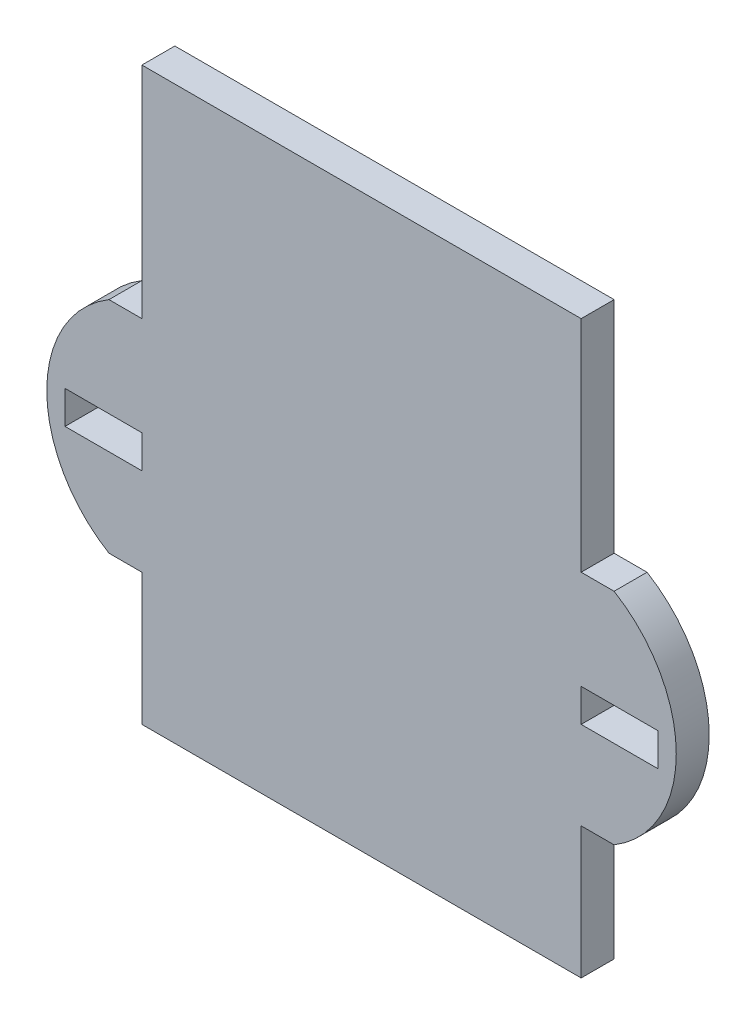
SolidWorks part; units mm, degrees
ref_plane "Plan de face" through (0, 0, 0) normal (0, 0, 1) x (1, 0, 0)
ref_plane "Plan de dessus" through (0, 0, 0) normal (0, 1, 0) x (1, 0, 0)
ref_plane "Plan de droite" through (0, 0, 0) normal (1, 0, 0) x (0, 0, -1)
sketch "Esquisse1" plane through (0, 0, 0) normal (0, 0, 1) x (1, 0, 0)
  line L0 (-18.614, 0) -> (-21.614, 0)
  line L1 (-18.614, 40) -> (21.386, 40)
  line L2 (-18.614, 40) -> (-18.614, 20)
  line L3 (-18.614, -12) -> (21.386, -12)
  line L4 (21.386, 40) -> (21.386, 20)
  line L6 (-21.614, 20) -> (-18.614, 20)
  line L7 (1.386, -12) -> (1.386, 40) construction
  line L8 (21.386, 0) -> (24.386, 0)
  line L10 (24.386, 20) -> (21.386, 20)
  line L11 (21.386, 0) -> (21.386, -12)
  line L12 (-18.614, 0) -> (-18.614, -12)
  line L13 (21.386, 20) -> (21.386, 0) construction
  line L14 (-18.614, 11) -> (-25.614, 11)
  line L15 (21.386, 11) -> (28.386, 11)
  line L16 (21.386, 11) -> (21.386, 8)
  line L17 (21.386, 8) -> (28.386, 8)
  line L18 (28.386, 11) -> (28.386, 8)
  line L19 (-25.614, 11) -> (-25.614, 8)
  line L20 (-18.614, 8) -> (-25.614, 8)
  line L21 (-18.614, 11) -> (-18.614, 8)
  arc A0 (24.386, 0) -> (24.386, 20) centre (18.386, 10) ccw
  arc A1 (-21.614, 0) -> (-21.614, 20) centre (-15.614, 10) cw
  dimension "D1" = 40
  dimension "D2" = 52
  dimension "D3" = 3
  dimension "D4" = 20
  dimension "D5" = 12
  dimension "D6" = 3
  dimension "D7" = 7
  dimension "D8" = 8
extrude "Boss.-Extru.1" add sketch "Esquisse1" along normal blind 3
